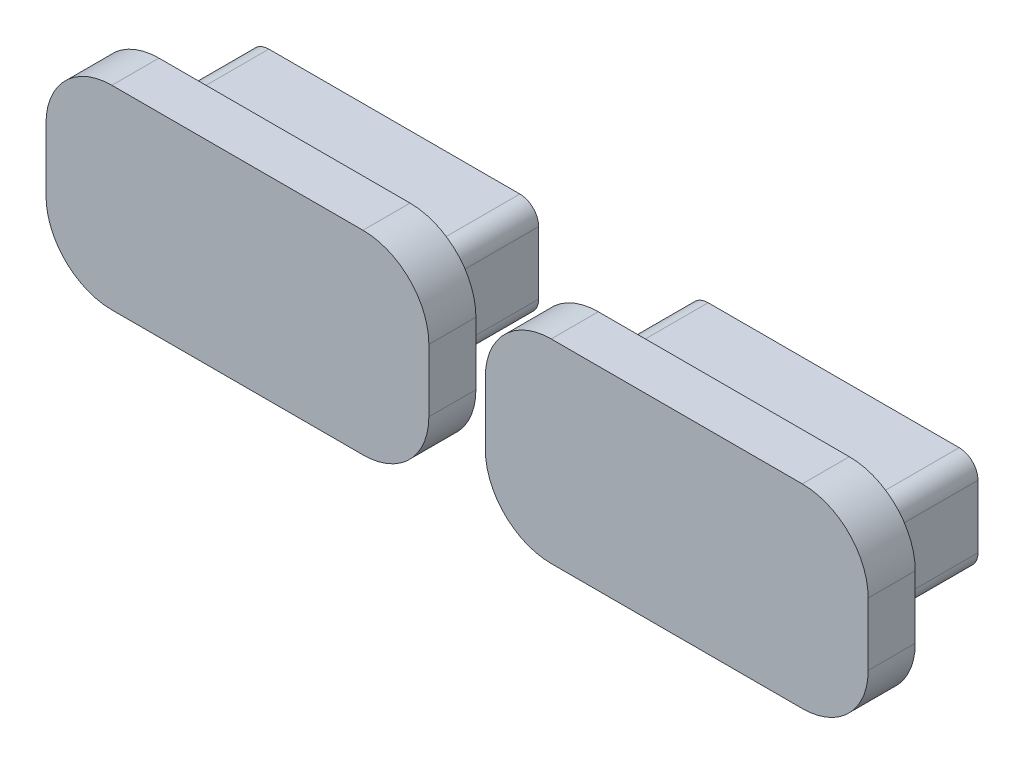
SolidWorks part; units mm, degrees
ref_plane "Front Plane" through (0, 0, 0) normal (0, 0, 1) x (1, 0, 0)
ref_plane "Top Plane" through (0, 0, 0) normal (0, 1, 0) x (1, 0, 0)
ref_plane "Right Plane" through (0, 0, 0) normal (1, 0, 0) x (0, 0, -1)
sketch "Sketch1" plane through (0, 0, 0) normal (0, 0, 1) x (1, 0, 0)
  line L9 (19.162, -55.245) -> (19.162, -52.705)
  line L10 (6.335, -57.912) -> (16.495, -57.912)
  line L11 (3.668, -52.705) -> (3.668, -55.245)
  line L12 (16.495, -50.038) -> (6.335, -50.038)
  line L13 (19.162, -55.245) -> (19.162, -52.705)
  line L14 (6.335, -57.912) -> (16.495, -57.912)
  line L15 (3.668, -52.705) -> (3.668, -55.245)
  line L16 (16.495, -50.038) -> (6.335, -50.038)
  line L22 (21.448, -52.705) -> (21.448, -55.245)
  line L23 (34.275, -50.038) -> (24.115, -50.038)
  line L24 (36.942, -55.245) -> (36.942, -52.705)
  line L25 (24.115, -57.912) -> (34.275, -57.912)
  line L26 (21.448, -52.705) -> (21.448, -55.245)
  line L27 (34.275, -50.038) -> (24.115, -50.038)
  line L28 (36.942, -55.245) -> (36.942, -52.705)
  line L29 (24.115, -57.912) -> (34.275, -57.912)
  arc A8 (19.162, -52.705) -> (16.495, -50.038) centre (16.495, -52.705) ccw
  arc A9 (16.495, -57.912) -> (19.162, -55.245) centre (16.495, -55.245) ccw
  arc A10 (3.668, -55.245) -> (6.335, -57.912) centre (6.335, -55.245) ccw
  arc A11 (6.335, -50.038) -> (3.668, -52.705) centre (6.335, -52.705) ccw
  arc A12 (19.162, -52.705) -> (16.495, -50.038) centre (16.495, -52.705) ccw
  arc A13 (16.495, -57.912) -> (19.162, -55.245) centre (16.495, -55.245) ccw
  arc A14 (3.668, -55.245) -> (6.335, -57.912) centre (6.335, -55.245) ccw
  arc A15 (6.335, -50.038) -> (3.668, -52.705) centre (6.335, -52.705) ccw
  arc A20 (21.448, -55.245) -> (24.115, -57.912) centre (24.115, -55.245) ccw
  arc A21 (24.115, -50.038) -> (21.448, -52.705) centre (24.115, -52.705) ccw
  arc A22 (36.942, -52.705) -> (34.275, -50.038) centre (34.275, -52.705) ccw
  arc A23 (34.275, -57.912) -> (36.942, -55.245) centre (34.275, -55.245) ccw
  arc A24 (21.448, -55.245) -> (24.115, -57.912) centre (24.115, -55.245) ccw
  arc A25 (24.115, -50.038) -> (21.448, -52.705) centre (24.115, -52.705) ccw
  arc A26 (36.942, -52.705) -> (34.275, -50.038) centre (34.275, -52.705) ccw
  arc A27 (34.275, -57.912) -> (36.942, -55.245) centre (34.275, -55.245) ccw
  dimension "D1" = 0.508
  dimension "D2" = 0.508
extrude "Boss-Extrude1" add sketch "Sketch1" against normal up to surface (1.905 mm away)
sketch "Sketch2" plane through (0, 0, -1.905) normal (0, 0, -1) x (-1, 0, 0)
  line L10 (-5.573, -55.245) -> (-5.573, -52.705)
  line L11 (-16.495, -56.007) -> (-6.335, -56.007)
  line L12 (-17.257, -52.705) -> (-17.257, -55.245)
  line L13 (-6.335, -51.943) -> (-16.495, -51.943)
  line L14 (-5.573, -55.245) -> (-5.573, -52.705)
  line L15 (-16.495, -56.007) -> (-6.335, -56.007)
  line L16 (-17.257, -52.705) -> (-17.257, -55.245)
  line L17 (-6.335, -51.943) -> (-16.495, -51.943)
  line L23 (-35.037, -52.705) -> (-35.037, -55.245)
  line L24 (-24.115, -51.943) -> (-34.275, -51.943)
  line L25 (-23.353, -55.245) -> (-23.353, -52.705)
  line L26 (-34.275, -56.007) -> (-24.115, -56.007)
  line L27 (-35.037, -52.705) -> (-35.037, -55.245)
  line L28 (-24.115, -51.943) -> (-34.275, -51.943)
  line L29 (-23.353, -55.245) -> (-23.353, -52.705)
  line L30 (-34.275, -56.007) -> (-24.115, -56.007)
  arc A8 (-6.335, -56.007) -> (-5.573, -55.245) centre (-6.335, -55.245) ccw
  arc A9 (-17.257, -55.245) -> (-16.495, -56.007) centre (-16.495, -55.245) ccw
  arc A10 (-16.495, -51.943) -> (-17.257, -52.705) centre (-16.495, -52.705) ccw
  arc A11 (-5.573, -52.705) -> (-6.335, -51.943) centre (-6.335, -52.705) ccw
  arc A12 (-6.335, -56.007) -> (-5.573, -55.245) centre (-6.335, -55.245) ccw
  arc A13 (-17.257, -55.245) -> (-16.495, -56.007) centre (-16.495, -55.245) ccw
  arc A14 (-16.495, -51.943) -> (-17.257, -52.705) centre (-16.495, -52.705) ccw
  arc A15 (-5.573, -52.705) -> (-6.335, -51.943) centre (-6.335, -52.705) ccw
  arc A20 (-34.275, -51.943) -> (-35.037, -52.705) centre (-34.275, -52.705) ccw
  arc A21 (-23.353, -52.705) -> (-24.115, -51.943) centre (-24.115, -52.705) ccw
  arc A22 (-24.115, -56.007) -> (-23.353, -55.245) centre (-24.115, -55.245) ccw
  arc A23 (-35.037, -55.245) -> (-34.275, -56.007) centre (-34.275, -55.245) ccw
  arc A24 (-34.275, -51.943) -> (-35.037, -52.705) centre (-34.275, -52.705) ccw
  arc A25 (-23.353, -52.705) -> (-24.115, -51.943) centre (-24.115, -52.705) ccw
  arc A26 (-24.115, -56.007) -> (-23.353, -55.245) centre (-24.115, -55.245) ccw
  arc A27 (-35.037, -55.245) -> (-34.275, -56.007) centre (-34.275, -55.245) ccw
  dimension "D1" = 0.508
  dimension "D2" = 0.508
extrude "Boss-Extrude2" add sketch "Sketch2" along normal up to surface (4.445 mm away)
